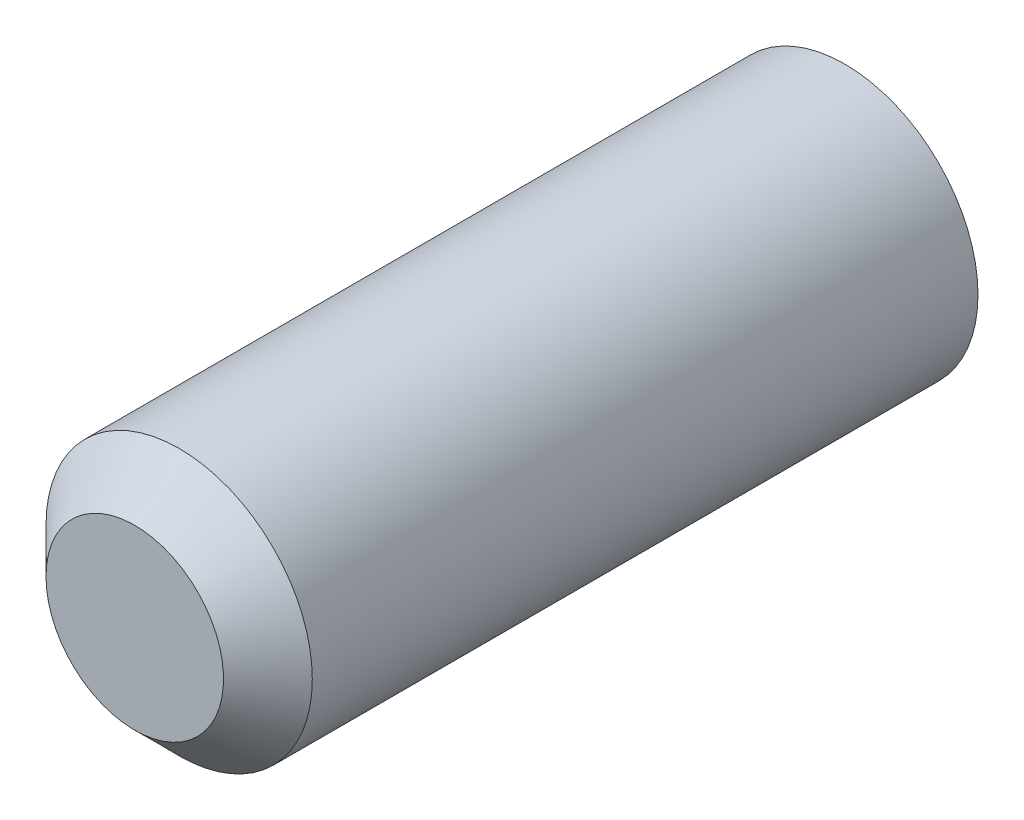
SolidWorks part; units mm, degrees
ref_plane "Front" through (0, 0, 0) normal (0, 0, 1) x (1, 0, 0)
ref_plane "Top" through (0, 0, 0) normal (0, 1, 0) x (1, 0, 0)
ref_plane "Right" through (0, 0, 0) normal (1, 0, 0) x (0, 0, -1)
sketch "Sketch1" plane through (0, 0, 0) normal (0, 0, 1) x (1, 0, 0)
  circle A0 centre (0, 0) radius 4.7625
  dimension "D1" = 9.525
extrude "Extrude1" add sketch "Sketch1" along normal blind 25.4
chamfer "Chamfer1" distance 1.5875 angle 45 1 edges at (4.7625, 0, 25.4)
